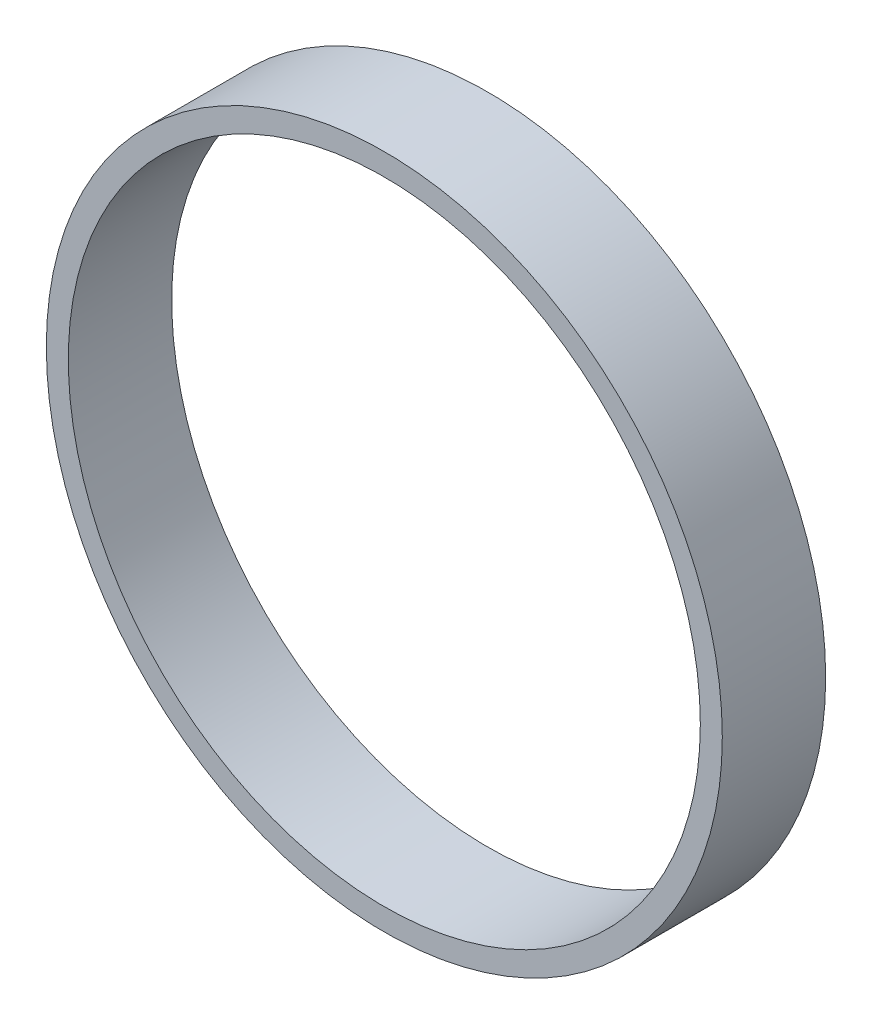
SolidWorks part; units mm, degrees
ref_plane "Front Plane" through (0, 0, 0) normal (0, 0, 1) x (1, 0, 0)
ref_plane "Top Plane" through (0, 0, 0) normal (0, 1, 0) x (1, 0, 0)
ref_plane "Right Plane" through (0, 0, 0) normal (1, 0, 0) x (0, 0, -1)
other "Configuration Table"
sketch "Sketch1" plane through (0, 0, 0) normal (0, 0, 1) x (1, 0, 0)
  circle A0 centre (0, 0) radius 77.65
  circle A1 centre (0, 0) radius 83.05
  dimension "Out_dia" = 166.1
  dimension "Thickness" = 5.4
extrude "BasePipe" add sketch "Sketch1" along normal mid plane 25.4
